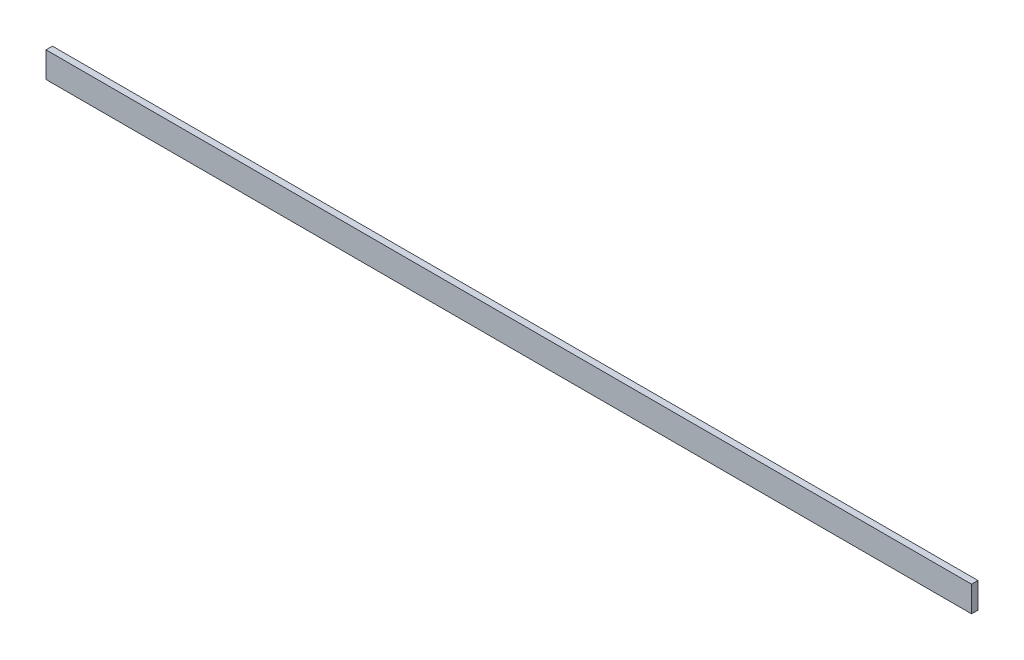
SolidWorks part; units mm, degrees
ref_plane "Front Plane" through (0, 0, 0) normal (1, 0, 0) x (0, 1, 0)
ref_plane "Top Plane" through (0, 0, 0) normal (0, 0, 1) x (0, 1, 0)
ref_plane "Right Plane" through (0, 0, 0) normal (0, 1, 0) x (-1, 0, 0)
sketch "Sketch1" plane through (0, 0, 0) normal (1, 0, 0) x (0, 1, 0)
  line L0 (-6.35, 0) -> (6.35, 0)
  line L1 (6.35, 0) -> (6.35, 3.175)
  line L2 (6.35, 3.175) -> (-6.35, 3.175)
  line L3 (-6.35, 3.175) -> (-6.35, 0)
extrude "Panel_or_block" add sketch "Sketch1" along normal blind 457.2
